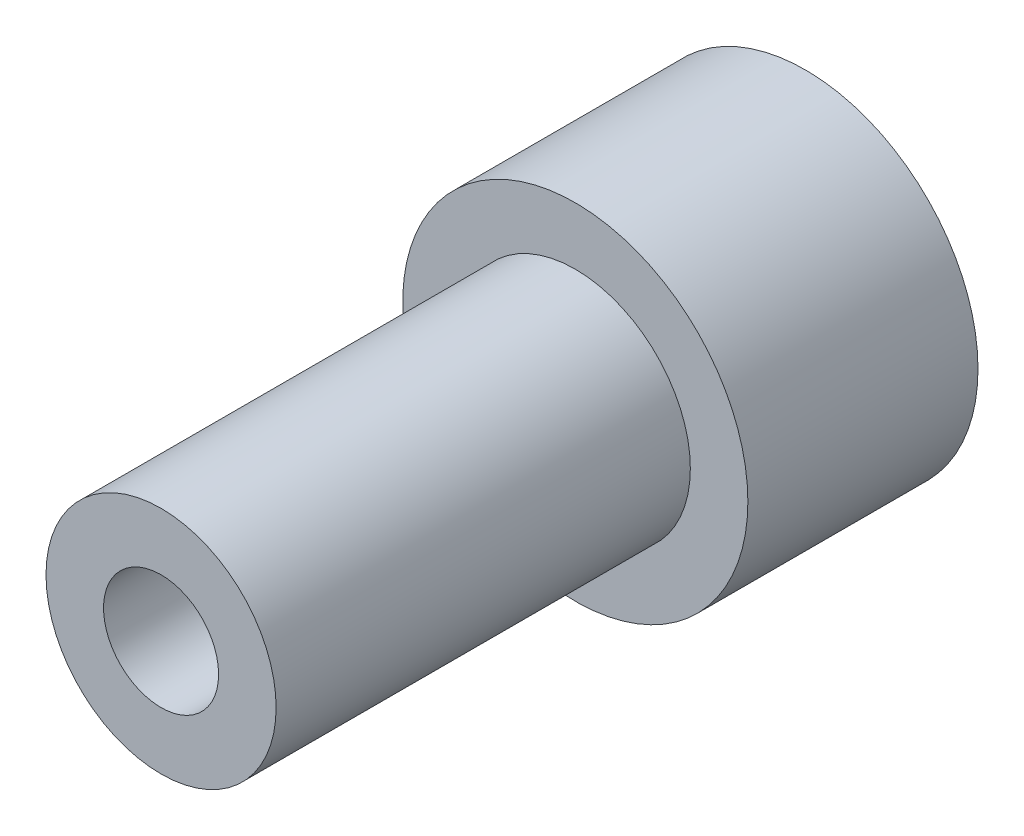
SolidWorks part; units mm, degrees
extrude "Base-Extrude" add sketch "Sketch1" along normal blind 6.35
sketch "Sketch1" plane through (0, 0, 0) normal (0, 0, 1) x (1, 0, 0)
  circle A0 centre (0, 0) radius 4.7625
  dimension "D1" = 9.525
extrude "Boss-Extrude1" add sketch "Sketch2" along normal blind 11.43
sketch "Sketch2" plane through (0, 0, 6.35) normal (0, 0, 1) x (1, 0, 0)
  circle A0 centre (0, 0) radius 3.175
  dimension "D1" = 6.35
extrude "Cut-Extrude1" cut sketch "Sketch3" against normal through all
sketch "Sketch3" plane through (0, 0, 17.78) normal (0, 0, 1) x (1, 0, 0)
  circle A0 centre (0, 0) radius 1.5875
  dimension "D1" = 3.175
ref_plane "Plane1" through (0, 0, 0) normal (0, 0, 1) x (1, 0, 0)
ref_plane "Plane2" through (0, 0, 0) normal (0, 1, 0) x (1, 0, 0)
ref_plane "Plane3" through (0, 0, 0) normal (1, 0, 0) x (0, 0, -1)
sketch "Sketch4" plane through (0, 0, 0) normal (0, 0, -1) x (-1, 0, 0)
  line L0 (0, 3.9566) -> (0, -3.9566) construction
  line L1 (2.3812, 1.3748) -> (2.3813, -1.3748)
  line L2 (0, 0) -> (2.3813, 0) construction
  line L3 (0, 0) -> (2.3812, 1.3748) construction
  line L4 (2.3812, 1.3748) -> (0, 2.7496)
  line L5 (-2.3812, 1.3748) -> (-2.3812, -1.3748)
  line L6 (-2.3812, 1.3748) -> (0, 2.7496)
  line L7 (0, -2.7496) -> (2.3813, -1.3748)
  line L8 (-2.3812, -1.3748) -> (0, -2.7496)
  dimension "D3" = 4.7625
extrude "Cut-Extrude2" cut sketch "Sketch4" against normal blind 3.683
